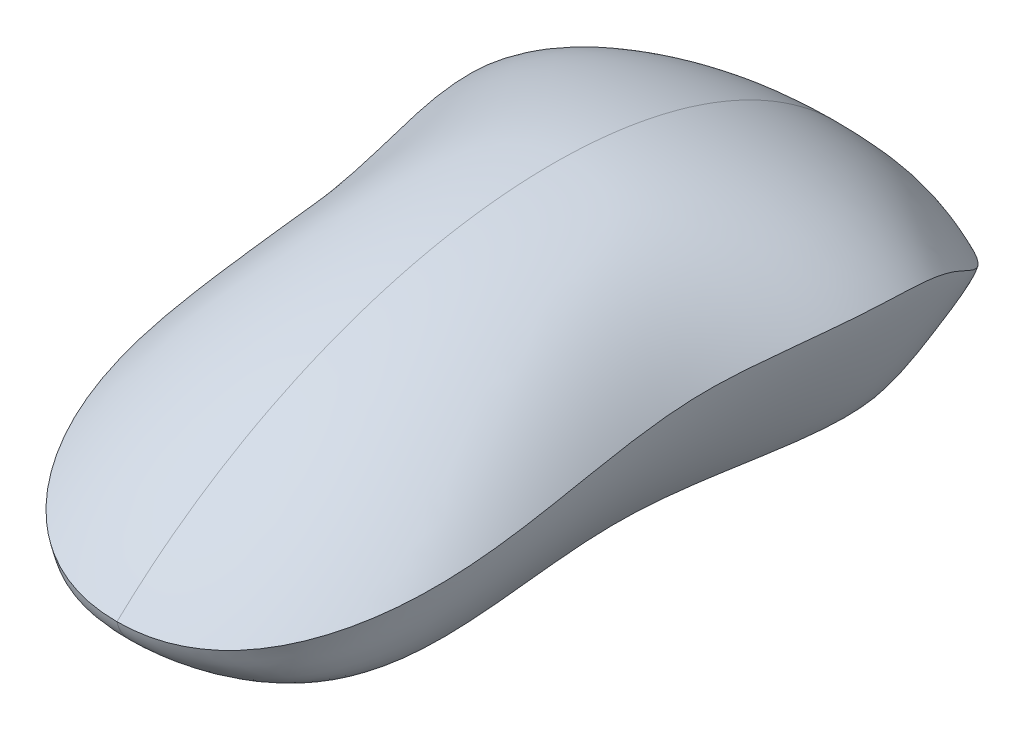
SolidWorks part; units mm, degrees
ref_plane "Front Plane" through (0, 0, 0) normal (0, 0, 1) x (1, 0, 0)
ref_plane "Top Plane" through (0, 0, 0) normal (0, 1, 0) x (1, 0, 0)
ref_plane "Right Plane" through (0, 0, 0) normal (1, 0, 0) x (0, 0, -1)
sketch "Size Reference" plane through (0, 0, 0) normal (0, 1, 0) x (1, 0, 0)
  line L1 (0, 0) -> (27, 0)
  line L2 (0, 0) -> (0, 123) construction
  line L3 (0, 123) -> (27, 123)
  line L4 (27, 0) -> (27, 123)
  dimension "D1" = 123
  dimension "D2" = 54
sketch "Bottom Edge" plane through (0, 0, 0) normal (0, 1, 0) x (1, 0, 0)
  line L0 (-13.8119, 123) -> (13.8119, 123) construction
  line L1 (10.1643, 0) -> (-10.902, 0) construction
  line L2 (27, 94.3329) -> (27, 117.9989) construction
  line L4 (27, 0) -> (27, 123) construction
  spline S0 degree 3 poles (0, 0) (14.1038, 0) (31.1867, 14.6677) (16.8512, 64.1582) (35.5643, 104.1058) (9.8237, 123) (0, 123) knots 0 0 0 0 0.180822 0.474162 0.789584 1 1 1 1
sketch "PL Top Profile" plane through (0, 0, 0) normal (0, 1, 0) x (1, 0, 0)
  line L0 (16.1692, 128.6) -> (-16.1692, 128.6) construction
  line L1 (-11.8443, -5.3) -> (11.8443, -5.3) construction
  spline S0 degree 3 poles (0, 128.6) (21.9606, 128.6) (41.6424, 98.0276) (26.6292, 64.4866) (36.8478, 17.4678) (14.8054, -5.3) (0, -5.3) knots 0 0 0 0 0.211426 0.475309 0.791996 1 1 1 1
  dimension "D1" = 5.6
  dimension "D2" = 5.3
sketch "PL Side Profile" plane through (0, 0, 0) normal (1, 0, 0) x (0, 0, -1)
  line L0 (135.0897, 6) -> (122.1103, 6) construction
  line L1 (93.6, 22) -> (93.6, 0) construction
  line L2 (123, 0) -> (0, 0) construction
  line L3 (128.6, 0) -> (-5.3, 0) construction
  spline S0 degree 3 poles (-5.3, 5.5) (21.4974, 14.2974) (54.5672, 20.6255) (94.0933, 22.5976) (109.3722, 19.381) (121.5178, 6) (128.6, 6) knots 0 0 0 0 0.610356 0.72302 0.836584 1 1 1 1
  dimension "D1" = 6
  dimension "D2" = 22
  dimension "D3" = 35
  dimension "D4" = 5.5
curve "PL Curve"
sketch "PL End Profiles" plane through (0, 0, 0) normal (1, 0, 0) x (0, 0, -1)
  line L0 (0, 0) -> (47.8103, -12.8107) construction
  line L1 (123, 0) -> (0, 0) construction
  arc A0 (-5.3, 5.5) -> (0, 0) centre (1.9158, 7.1497) ccw
  arc A1 (123, 0) -> (128.6, 6) centre (119.1334, 9.2222) ccw
  dimension "D2" = 10
  dimension "D1" = 15
ref_plane "Mid Plane" through (0, 0, -60.8074) normal (0, 0, 1) x (1, 0, 0)
sketch "Intermediate Profile" plane through (0, 0, -60.8074) normal (0, 0, 1) x (1, 0, 0)
  line L0 (23.0474, 0) -> (31.2173, 20.0401) construction
  arc A0 (31.2173, 20.0401) -> (23.0474, 0) centre (-15.6586, 27.4651) cw
  dimension "D1" = 1.25
surface "Surface-Loft1"
sketch "Sketch7" plane through (0, 0, 0) normal (1, 0, 0) x (0, 0, -1)
  line L0 (21.4445, 24.3528) -> (50.9539, -33.5627) construction
  line L2 (123, 0) -> (0, 0) construction
  ellipse E0 centre (50.9539, -33.5627) end of major axis (-26.6921, -73.1253) minor radius 65 (128.6, 6) -> (-5.3, 5.5) ccw
  dimension "D1" = 117
  dimension "D2" = 65
surface "Surface-Extrude1" sketch "Sketch7" parameters "D1"=10
surface "Surface-Fill1"
mirror "Mirror1" about plane through (0, 0, 0) normal (1, 0, 0)
surface "Surface-Plane1"
surface "Surface-Knit1"
